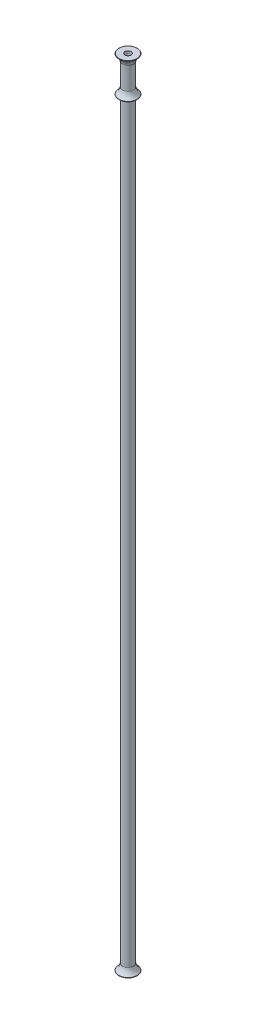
SolidWorks part; units mm, degrees
ref_plane "Plan de face" through (0, 0, 0) normal (0, 0, 1) x (1, 0, 0)
ref_plane "Plan de dessus" through (0, 0, 0) normal (0, 1, 0) x (1, 0, 0)
ref_plane "Plan de coté" through (0, 0, 0) normal (1, 0, 0) x (0, 0, -1)
sketch "Esquisse1" plane through (0, 0, 0) normal (0, 0, 1) x (1, 0, 0)
  line L0 (0, 0) -> (0, 1614.6465) construction
  line L1 (6, 0) -> (17.5, 0)
  line L2 (6, 0) -> (6, 1560)
  line L3 (6, 1560) -> (17.5, 1560)
  line L4 (10.75, 1547) -> (10.75, 1503)
  line L5 (10.75, 13) -> (10.75, 1490)
  line L6 (10.75, 1490) -> (17.5, 1490)
  arc A0 (17.5, 1560) -> (17.8161, 1559.1126) centre (17.5, 1559.5) cw
  arc A1 (17.8161, 1559.1126) -> (10.75, 1547) centre (30.462, 1543.618) ccw
  arc A2 (17.5, 0) -> (17.8161, 0.8874) centre (17.5, 0.5) ccw
  arc A3 (17.8161, 0.8874) -> (10.75, 13) centre (30.462, 16.382) cw
  arc A4 (17.5, 1490) -> (17.8161, 1490.8874) centre (17.5, 1490.5) ccw
  arc A5 (17.8161, 1490.8874) -> (10.75, 1503) centre (30.462, 1506.382) cw
  point P19 (0, 0)
  dimension "D3" = 0.5
  dimension "D2" = 21.5
  dimension "D5" = 36
  dimension "D7" = 20
  dimension "D1" = 1560
  dimension "D4" = 12
  dimension "D6" = 13
  dimension "D8" = 13
  dimension "D9" = 13
  dimension "D10" = 70
revolve "Révolution1" add sketch "Esquisse1" angle 360 about L0
